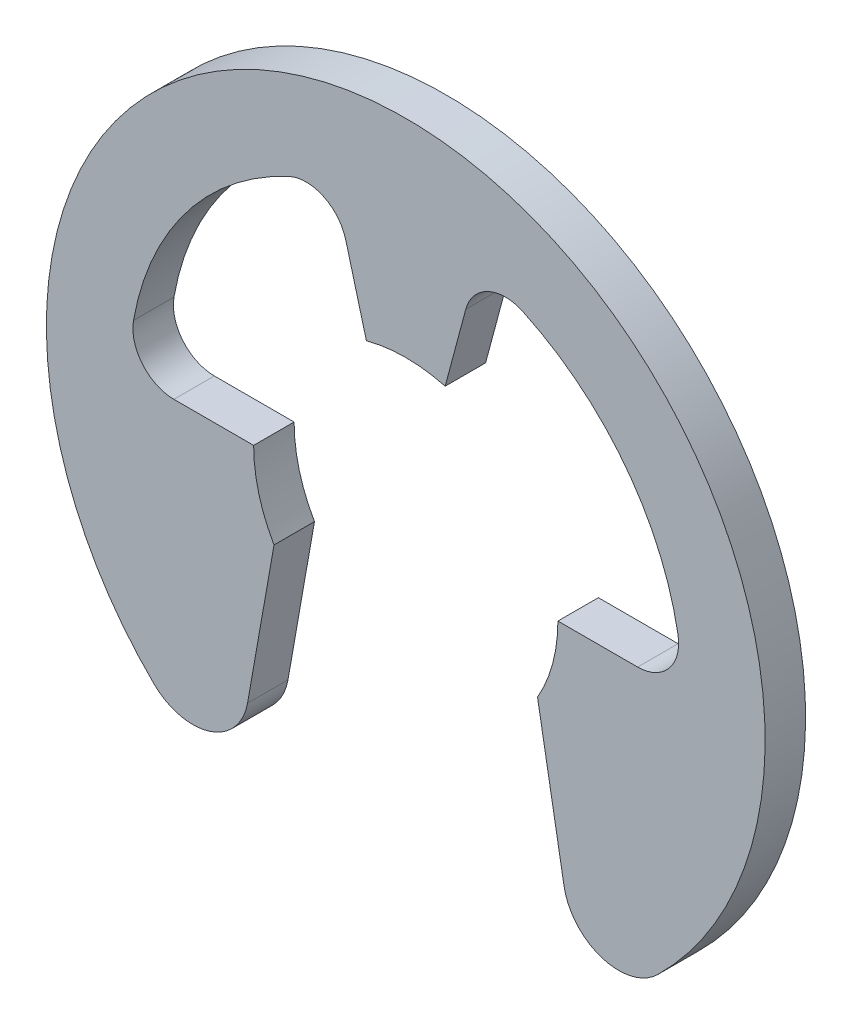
SolidWorks part; units mm, degrees
ref_plane "Plane1" through (0, 0, 0) normal (0, 0, 1) x (1, 0, 0)
ref_plane "Plane2" through (0, 0, 0) normal (0, 1, 0) x (1, 0, 0)
ref_plane "Plane3" through (0, 0, 0) normal (1, 0, 0) x (0, 0, -1)
sketch "Clipboard" plane through (0, 0, 0) normal (0, 0, 1) x (1, 0, 0)
  line L0 (0, 0) -> (1.3009, 0)
  circle A0 centre (0, 0) radius 2.3495
  circle A1 centre (0, 0) radius 5.5499
  dimension "FreeID" = 4.699
  dimension "FreeOD" = 11.0998
  dimension "Bridge" = 1.3009
sketch "BodySke" plane through (0, 0, 0) normal (0, 0, 1) x (1, 0, 0)
  line L0 (-0.7581, 0) -> (0.7581, 0) construction
  line L1 (0, 0) -> (0, 2.3876) construction
  line L2 (0, 0) -> (0.1962, 0.7323) construction
  line L3 (0, 0) -> (2.0677, -1.1938) construction
  line L4 (0, 0) -> (-0.1962, 0.7323) construction
  line L5 (0, 0) -> (-2.0677, -1.1938) construction
  line L6 (2.0677, -1.1938) -> (2.4836, -3.5525)
  line L7 (-2.0677, -1.1938) -> (-2.4836, -3.5525)
  line L9 (2.3876, 0) -> (3.6385, 0)
  line L10 (-2.3876, 0) -> (-3.6385, 0)
  line L11 (0.618, 2.3062) -> (0.9417, 3.5145)
  line L12 (-0.618, 2.3062) -> (-0.9417, 3.5145)
  circle A0 centre (0, 0) radius 2.3876 construction
  arc A1 (4.2726, 0.7562) -> (1.8362, 3.9313) centre (0, 0) ccw
  arc A2 (3.9529, -4.0228) -> (-3.9529, -4.0228) centre (0, 0) ccw
  arc A3 (2.0677, -1.1938) -> (2.3876, 0) centre (0, 0) ccw
  arc A4 (-1.8362, 3.9313) -> (-4.2726, 0.7562) centre (0, 0) ccw
  arc A5 (-2.3876, 0) -> (-2.0677, -1.1938) centre (0, 0) ccw
  arc A6 (-0.618, 2.3062) -> (0.618, 2.3062) centre (0, 0) cw
  arc A7 (1.8362, 3.9313) -> (0.9417, 3.5145) centre (1.5637, 3.3478) ccw
  arc A8 (2.4836, -3.5525) -> (3.9529, -4.0228) centre (3.342, -3.4011) ccw
  arc A9 (-3.9529, -4.0228) -> (-2.4836, -3.5525) centre (-3.342, -3.4011) ccw
  arc A10 (-4.2726, 0.7562) -> (-3.6385, 0) centre (-3.6385, 0.644) ccw
  arc A11 (-0.9417, 3.5145) -> (-1.8362, 3.9313) centre (-1.5637, 3.3478) ccw
  arc A12 (3.6385, 0) -> (4.2726, 0.7562) centre (3.6385, 0.644) ccw
  dimension "D1" = 30
  dimension "GrooveDia" = 4.7752
  dimension "OutsideDia" = 11.2798
  dimension "D3" = 30
  dimension "TipRad" = 0.8716
  dimension "CavityDia" = 8.678
  dimension "CavityFilletRad" = 0.644
  dimension "D4" = 20
extrude "Body" add sketch "BodySke" against normal blind 0.635
equation "' \"FreeID@Clipboard\" = 0.025"
equation "' \"Thickness@Body\" = 0.01"
equation "' \"GrooveDia@BodySke\" = 0.026"
equation "' \"FreeOD@Clipboard\" = 0.079"
equation "' \"FreeID@Clipboard\" = 1.213"
equation "' \"Thickness@Body\" = 0.062"
equation "' \"GrooveDia@BodySke\" = 1.23"
equation "' \"FreeOD@Clipboard\" = 1.875"
equation "\"OutsideDia@BodySke\" = ( \"GrooveDia@BodySke\"  /  \"FreeID@Clipboard\" )  * \"FreeOD@Clipboard\""
equation "\"Bridge@Clipboard\" =  (\"OutsideDia@BodySke\" - \"GrooveDia@BodySke\") / 2 * 0.4"
equation "\"CavityDia@BodySke\" = \"OutsideDia@BodySke\"  - 2 * \"Bridge@Clipboard\""
equation "\"CavityFilletRad@BodySke\" =  (\"CavityDia@BodySke\" - \"GrooveDia@BodySke\") / 2 * 0.33"
equation "\"TipRad@BodySke\" = 0.67 * \"Bridge@Clipboard\""
